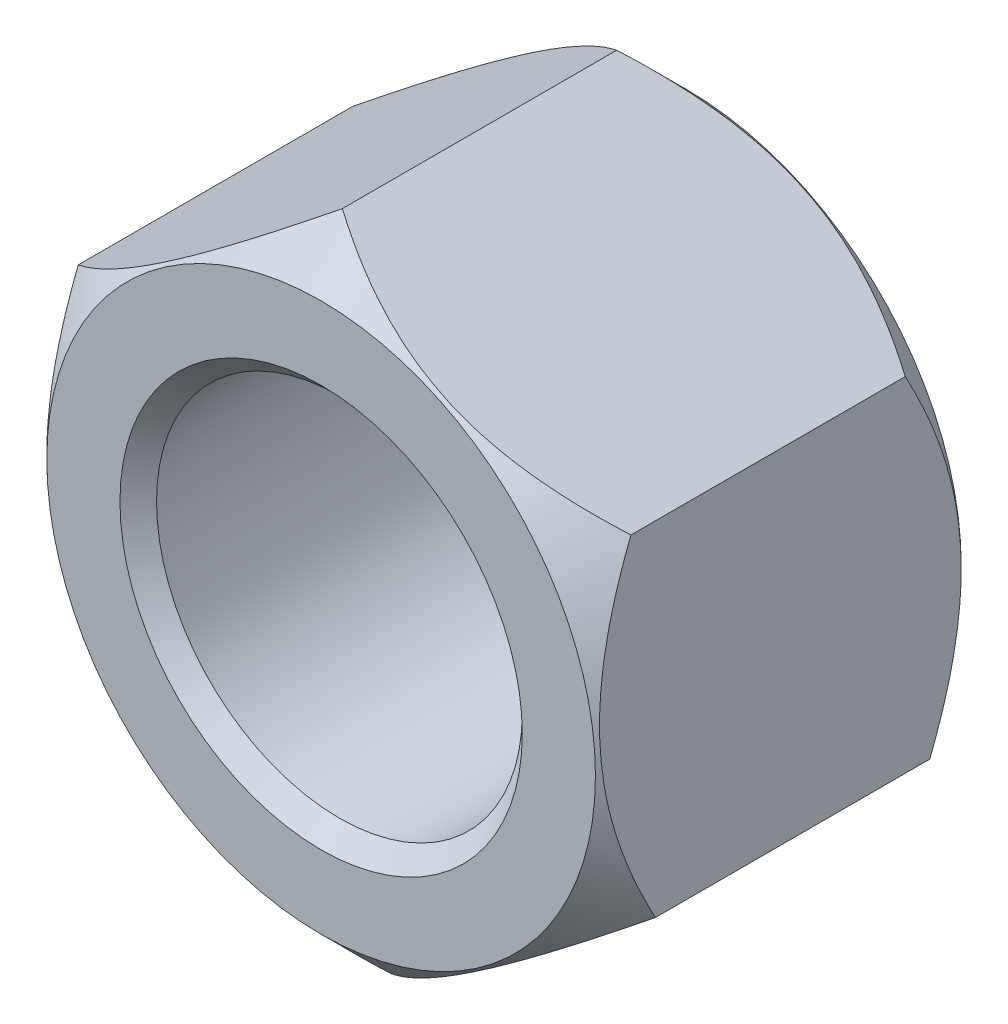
SolidWorks part; units mm, degrees
ref_plane "Plan de face" through (0, 0, 0) normal (0, 0, 1) x (1, 0, 0)
ref_plane "Plan de dessus" through (0, 0, 0) normal (0, 1, 0) x (1, 0, 0)
ref_plane "Plan de droite" through (0, 0, 0) normal (1, 0, 0) x (0, 0, -1)
sketch "Esquisse1" plane through (0, 0, 0) normal (0, 0, 1) x (1, 0, 0)
  circle A0 centre (0, 0) radius 3.5
  circle A1 centre (0, 0) radius 2
  dimension "D1" = 4
  dimension "D2" = 7
extrude "Boss.-Extru.1" add sketch "Esquisse1" along normal blind 4
chamfer "Chanfrein1" distance 0.5 angle 45 2 edges at (3.5, 0, 0) (3.5, 0, 4)
sketch "Esquisse2" plane through (0, 0, 4) normal (0, 0, 1) x (1, 0, 0)
  line L6 (-3.1561, 1.513) -> (-0.2677, 3.4897)
  arc A0 (-0.2677, 3.4897) -> (-3.1561, 1.513) centre (0, 0) ccw
  point P11 (0, 0)
  dimension "D1" = 7
extrude "Enlèv. mat.-Extru.1" cut sketch "Esquisse2" against normal through all
pattern_circular "Répétition circulaire1" count 6 every 60 about axis through (0, 0, 0) along (0, 0, 1) of "Enlèv. mat.-Extru.1"
chamfer "Chanfrein2" distance 0.2 angle 45 2 edges at (2, 0, 0) (2, 0, 4)
